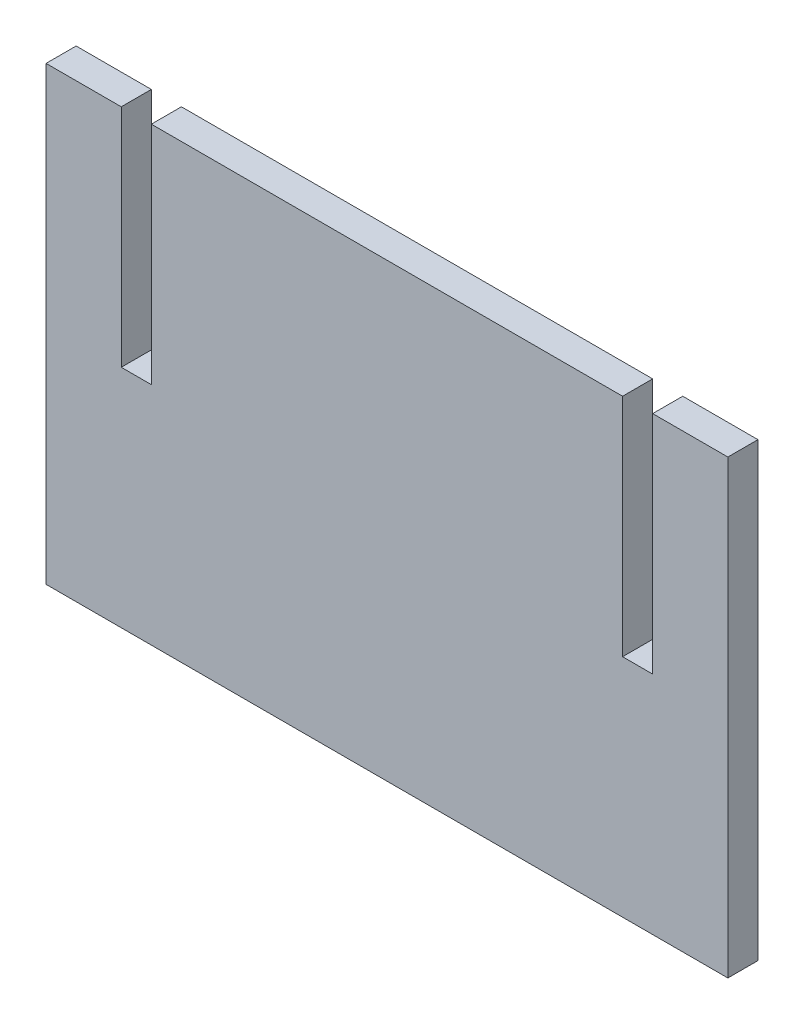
SolidWorks part; units mm, degrees
ref_plane "Alzado" through (0, 0, 0) normal (1, 0, 0) x (0, 1, 0)
ref_plane "Planta" through (0, 0, 0) normal (0, 0, 1) x (0, 1, 0)
ref_plane "Vista lateral" through (0, 0, 0) normal (0, 1, 0) x (-1, 0, 0)
sketch "Sketch3" plane through (0, 0, 0) normal (0, 0, 1) x (0, 1, 0)
  line L0 (90, 106) -> (90, 94)
  line L1 (-90, 136) -> (90, 136)
  line L2 (-90, 136) -> (-90, -136)
  line L3 (-90, -136) -> (90, -136)
  line L4 (90, 136) -> (90, -136)
  line L5 (-90, 136) -> (90, -136) construction
  line L6 (-90, -136) -> (90, 136) construction
  line L7 (90, -94) -> (0, -94)
  line L8 (90, -94) -> (90, -106)
  line L9 (90, -106) -> (0, -106)
  line L10 (0, -94) -> (0, -106)
  line L11 (90, 106) -> (0, 106)
  line L12 (0, 106) -> (0, 94)
  line L13 (90, 94) -> (0, 94)
  line L14 (90, -94) -> (90, 106) construction
  point P0 (0, 0)
extrude "Boss-Extrude1" add sketch "Sketch3" along normal blind 12
equation "\"L\"=180"
equation "\"D1@Sketch3\"=\"L\""
equation "\"W\"=12"
equation "\"D3@Sketch3\"=\"W\""
equation "\"D4@Sketch3\"=\"L\"/2"
equation "\"H\"=1700"
equation "\"D2@Sketch3\" = ( ( \"K\" * ( \"N\" - 1 ) ) + ( \"B\" * 2 ) ) + \"W\""
equation "\"B\"= 30"
equation "\"D5@Sketch3\"=\"B\""
equation "\"K\"=200"
equation "\"D7@Sketch3\"=\"K\""
equation "\"D6@Sketch3\"=\"N\""
equation "\"N\"=2"
